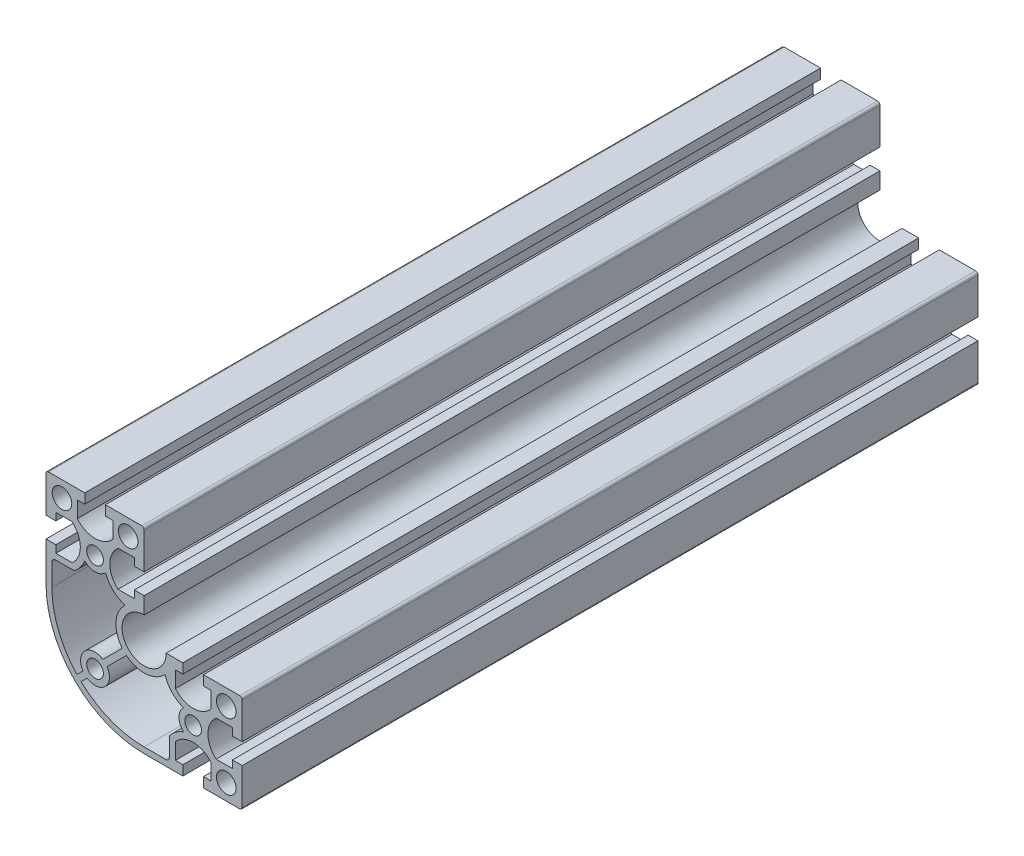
SolidWorks part; units mm, degrees
ref_plane "前视基准面" through (0, 0, 0) normal (0, 0, 1) x (1, 0, 0)
ref_plane "上视基准面" through (0, 0, 0) normal (0, 1, 0) x (1, 0, 0)
ref_plane "右视基准面" through (0, 0, 0) normal (1, 0, 0) x (0, 0, -1)
sketch "草图1" plane through (0, 0, 0) normal (0, 0, 1) x (1, 0, 0)
  line B0 (36, -15.8) -> (40, -15.8)
  line B1 (40, -15.8) -> (40, -1)
  line B2 (39, 0) -> (24.2, 0)
  line B3 (24.2, 0) -> (24.2, -4)
  line B4 (24.2, -4) -> (27.25, -4)
  line B5 (27.25, -4) -> (27.25, -10.639)
  line B6 (12.75, -10.639) -> (12.75, -4)
  line B7 (12.75, -4) -> (15.8, -4)
  line B8 (15.8, -4) -> (15.8, 0)
  line B9 (15.8, 0) -> (9, 0)
  line B10 (0, 9) -> (0, 15.8)
  line B11 (0, 15.8) -> (-4, 15.8)
  line B12 (-4, 15.8) -> (-4, 12.75)
  line B13 (-4, 12.75) -> (-10.639, 12.75)
  line B14 (-10.639, 27.25) -> (-4, 27.25)
  line B15 (-4, 27.25) -> (-4, 24.2)
  line B16 (-4, 24.2) -> (0, 24.2)
  line B17 (0, 24.2) -> (0, 39)
  line B18 (-1, 40) -> (-15.8, 40)
  line B19 (-15.8, 40) -> (-15.8, 36)
  line B20 (-15.8, 36) -> (-12.75, 36)
  line B21 (-12.75, 36) -> (-12.75, 29.361)
  line B22 (-27.25, 29.361) -> (-27.25, 36)
  line B23 (-27.25, 36) -> (-24.2, 36)
  line B24 (-24.2, 36) -> (-24.2, 40)
  line B25 (-24.2, 40) -> (-39, 40)
  line B26 (-40, 39) -> (-40, 24.2)
  line B27 (-40, 24.2) -> (-36, 24.2)
  line B28 (-36, 24.2) -> (-36, 27.25)
  line B29 (-36, 27.25) -> (-29.361, 27.25)
  line B30 (-29.361, 12.75) -> (-36, 12.75)
  line B31 (-36, 12.75) -> (-36, 15.8)
  line B32 (-36, 15.8) -> (-40, 15.8)
  line B33 (-40, 15.8) -> (-40, 0)
  line B34 (0, -40) -> (15.8, -40)
  line B35 (15.8, -40) -> (15.8, -36)
  line B36 (15.8, -36) -> (12.75, -36)
  line B37 (12.75, -36) -> (12.75, -29.361)
  line B38 (27.25, -29.361) -> (27.25, -36)
  line B39 (27.25, -36) -> (24.2, -36)
  line B40 (24.2, -36) -> (24.2, -40)
  line B41 (24.2, -40) -> (39, -40)
  line B42 (40, -39) -> (40, -24.2)
  line B43 (40, -24.2) -> (36, -24.2)
  line B44 (36, -24.2) -> (36, -27.25)
  line B45 (36, -27.25) -> (29.361, -27.25)
  line B46 (29.361, -12.75) -> (36, -12.75)
  line B47 (36, -12.75) -> (36, -15.8)
  line B48 (10.35, -36.1) -> (10.35, -28.5367)
  line B49 (-7.2388, -8.9359) -> (-15.0667, -16.7638)
  line B50 (-23.2362, -24.9333) -> (-25.7251, -27.4222)
  line B51 (0, -37.6) -> (8.85, -37.6)
  line B52 (-28.5367, 10.35) -> (-36.1, 10.35)
  line B53 (-37.6, 8.85) -> (-37.6, 0)
  line B54 (-27.4222, -25.7251) -> (-24.9333, -23.2362)
  line B55 (-16.7638, -15.0667) -> (-8.9359, -7.2388)
  arc B56 (40, -1) -> (39, 0) centre (39, -1) ccw
  arc B57 (12.75, -10.639) -> (27.25, -10.639) centre (20, -4.5) ccw
  arc B58 (0, 9) -> (9, 0) centre (0, 0) ccw
  arc B59 (-10.639, 27.25) -> (-10.639, 12.75) centre (-4.5, 20) ccw
  arc B60 (0, 39) -> (-1, 40) centre (-1, 39) ccw
  arc B61 (-27.25, 29.361) -> (-12.75, 29.361) centre (-20, 35.5) ccw
  arc B62 (-39, 40) -> (-40, 39) centre (-39, 39) ccw
  arc B63 (-29.361, 12.75) -> (-29.361, 27.25) centre (-35.5, 20) ccw
  arc B64 (-40, 0) -> (0, -40) centre (0, 0) ccw
  arc B65 (27.25, -29.361) -> (12.75, -29.361) centre (20, -35.5) ccw
  arc B66 (39, -40) -> (40, -39) centre (39, -39) ccw
  arc B67 (29.361, -12.75) -> (29.361, -27.25) centre (35.5, -20) ccw
  circle B68 centre (20, -20) radius 3.4
  circle B69 centre (33.5, -33.5) radius 4
  circle B70 centre (33.5, -6.5) radius 4
  arc B71 (8.85, -37.6) -> (10.35, -36.1) centre (8.85, -36.1) ccw
  arc B72 (16.0717, -24.2671) -> (10.35, -28.5367) centre (20, -35.5) ccw
  arc B73 (16.0717, -15.7329) -> (16.0717, -24.2671) centre (20, -20) ccw
  arc B74 (8.5391, -7.7028) -> (16.0717, -15.7329) centre (20, -4.5) ccw
  arc B75 (-7.2388, -8.9359) -> (8.5391, -7.7028) centre (0, 0) ccw
  arc B76 (-23.2362, -24.9333) -> (-15.0667, -16.7638) centre (-20, -20) ccw
  arc B77 (-25.7251, -27.4222) -> (0, -37.6) centre (0, 0) ccw
  arc B78 (-24.2671, 16.0717) -> (-15.7329, 16.0717) centre (-20, 20) ccw
  arc B79 (-28.5367, 10.35) -> (-24.2671, 16.0717) centre (-35.5, 20) ccw
  arc B80 (-36.1, 10.35) -> (-37.6, 8.85) centre (-36.1, 8.85) ccw
  arc B81 (-37.6, 0) -> (-27.4222, -25.7251) centre (0, 0) ccw
  arc B82 (-16.7638, -15.0667) -> (-24.9333, -23.2362) centre (-20, -20) ccw
  arc B83 (-7.7028, 8.5391) -> (-8.9359, -7.2388) centre (0, 0) ccw
  arc B84 (-15.7329, 16.0717) -> (-7.7028, 8.5391) centre (-4.5, 20) ccw
  circle B85 centre (-6.5, 33.5) radius 4
  circle B86 centre (-20, -20) radius 3.4
  circle B87 centre (-33.5, 33.5) radius 4
  circle B88 centre (-20, 20) radius 3.4
sketch_block_instance "A$C08C16CCB-1"
sketch_block "A$C08C16CCB"
extrude "凸台-拉伸1" add sketch "草图1" along normal mid plane 300
